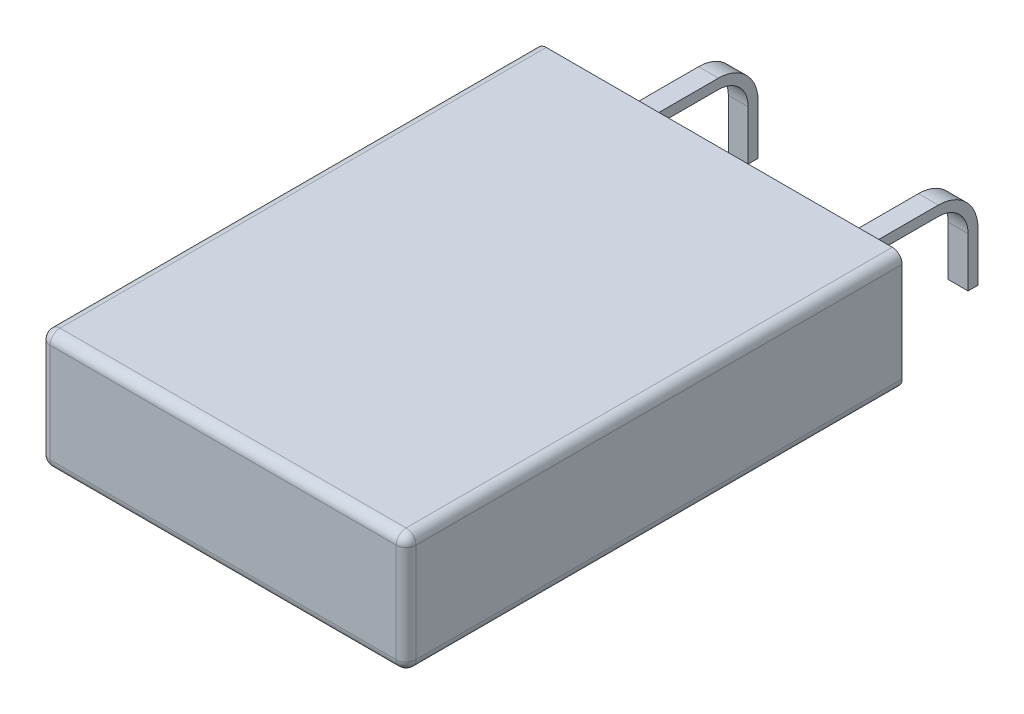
SolidWorks part; units mm, degrees
ref_plane "Front" through (0, 0, 0) normal (0, 0, 1) x (1, 0, 0)
ref_plane "Top" through (0, 0, 0) normal (0, 1, 0) x (1, 0, 0)
ref_plane "Right" through (0, 0, 0) normal (1, 0, 0) x (0, 0, -1)
sketch "Sketch2" plane through (0, 0, 0) normal (0, 0, 1) x (1, 0, 0)
  line L1 (0.5, 0) -> (17.94, 0)
  line L2 (0, 0.5) -> (0, 5.5)
  line L3 (0.5, 6) -> (17.94, 6)
  line L4 (18.44, 0.5) -> (18.44, 5.5)
  arc A0 (17.94, 6) -> (18.44, 5.5) centre (17.94, 5.5) cw
  arc A1 (17.94, 0) -> (18.44, 0.5) centre (17.94, 0.5) ccw
  arc A2 (0, 5.5) -> (0.5, 6) centre (0.5, 5.5) cw
  arc A3 (0.5, 0) -> (0, 0.5) centre (0.5, 0.5) cw
  point P6 (18.44, 6)
  point P9 (18.44, 0)
  point P12 (0, 6)
  point P15 (0, 0)
  dimension "D3" = 0.5
  dimension "D1" = 18.44
  dimension "D2" = 6
extrude "Extrude1" add sketch "Sketch2" against normal blind 25
fillet "Fillet1" radius 0.5 8 edges at (18.2936, 5.8536, 0) (18.44, 3, 0) (18.2936, 0.1464, 0) (9.22, 0, 0) (0.1464, 0.1464, 0) (0, 3, 0) (0.1464, 5.8536, 0) (9.22, 6, 0)
sketch "Sketch3" plane through (0, 0, -25) normal (0, 0, -1) x (-1, 0, 0)
  line L8 (-17.44, 5) -> (-17.44, 1)
  line L9 (-17.44, 1) -> (-1, 1)
  line L10 (-1, 1) -> (-1, 5)
  line L11 (-1, 5) -> (-17.44, 5)
  line L12 (-17.44, 5) -> (-17.44, 1)
  line L13 (-17.44, 1) -> (-1, 1)
  line L14 (-1, 1) -> (-1, 5)
  line L15 (-1, 5) -> (-17.44, 5)
  dimension "D1" = 1
extrude "Cut-Extrude1" cut sketch "Sketch3" against normal blind 5
sketch "Profile" plane through (0, 0, -20) normal (0, 0, -1) x (-1, 0, 0)
  line L0 (-0.5, 0) -> (-17.94, 0) construction
  line L1 (-15.26, 4) -> (-14.26, 4)
  line L2 (-15.26, 4) -> (-15.26, 3.5)
  line L3 (-15.26, 3.5) -> (-14.26, 3.5)
  line L4 (-14.26, 4) -> (-14.26, 3.5)
  line L5 (-18.44, 0.5) -> (-18.44, 5.5) construction
  line L6 (-9.22, 6) -> (-9.22, 0) construction
  line L7 (-17.94, 6) -> (-0.5, 6) construction
  line L8 (-4.18, 4) -> (-4.18, 3.5)
  line L9 (-3.18, 3.5) -> (-4.18, 3.5)
  line L10 (-3.18, 4) -> (-3.18, 3.5)
  line L11 (-3.18, 4) -> (-4.18, 4)
  dimension "D1" = 1
  dimension "D2" = 0.5
  dimension "D3" = 4
  dimension "D4" = 3.18
ref_plane "Plane2" through (9.22, 0, 0) normal (1, 0, 0) x (0, 0, -1)
sketch "Path" plane through (9.22, 0, 0) normal (1, 0, 0) x (0, 0, -1)
  line L0 (20, 3.5) -> (30, 3.5)
  line L1 (20, 4) -> (20, 3.5) construction
  line L2 (31.5, 2) -> (31.5, -0.5)
  arc A0 (30, 3.5) -> (31.5, 2) centre (30, 2) cw
  point P8 (31.5, 3.5)
  dimension "D3" = 1.5
  dimension "D1" = 11.5
  dimension "D2" = 4
sweep "Sweep1" add profiles "Profile" path "Path"
